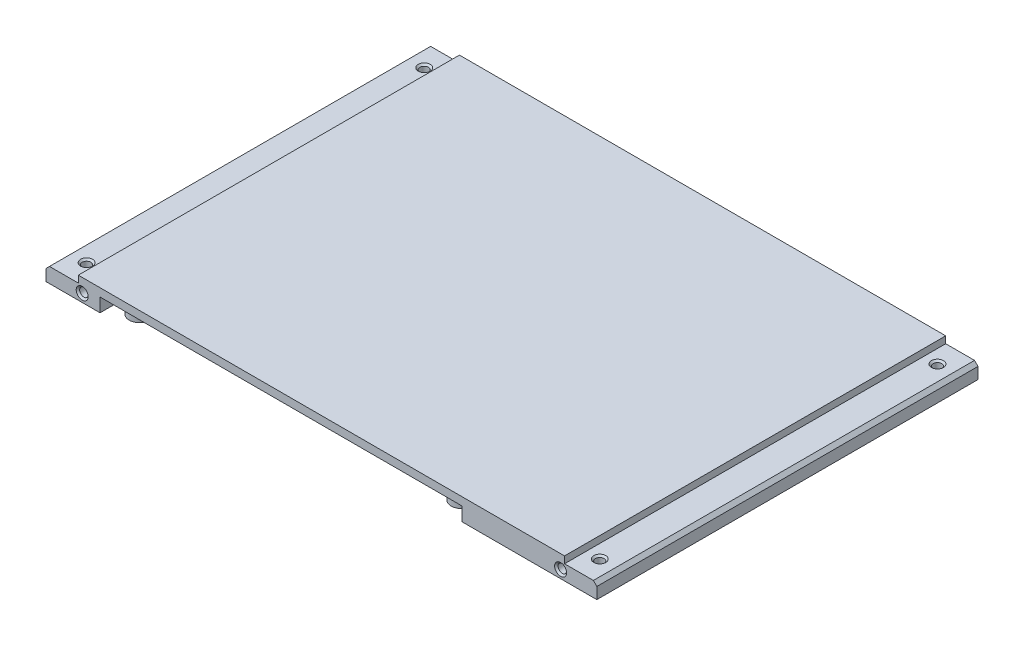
SolidWorks part; units mm, degrees
ref_plane "Front Plane" through (0, 0, 0) normal (0, 0, 1) x (1, 0, 0)
ref_plane "Top Plane" through (0, 0, 0) normal (0, 1, 0) x (1, 0, 0)
ref_plane "Right Plane" through (0, 0, 0) normal (1, 0, 0) x (0, 0, -1)
sketch "Sketch1" plane through (0, 0, 0) normal (0, 0, 1) x (1, 0, 0)
  line L0 (-70.993, -2) -> (-80.423, -2)
  line L1 (-80.423, -2) -> (-80.423, -6.35)
  line L2 (-80.423, -6.35) -> (80.423, -6.35)
  line L4 (-70.993, -2) -> (-70.993, 0)
  line L5 (-70.993, 0) -> (70.993, 0)
  line L6 (0, -34.925) -> (0, 34.925) construction
  line L7 (80.423, -2) -> (80.423, -6.35)
  line L8 (70.993, -2) -> (80.423, -2)
  line L9 (70.993, -2) -> (70.993, 0)
  line L10 (62.865, -6.35) -> (-62.865, -6.35) construction
extrude "Boss-Extrude1" add sketch "Sketch1" against normal up to surface (111.3 mm away)
sketch "Sketch4" plane through (0, -6.35, 0) normal (0, -1, 0) x (1, 0, 0)
  line L0 (-64.643, 0) -> (-64.643, -77.5615)
  line L1 (-82.55, 0) -> (82.55, 0) construction
  line L2 (-64.643, -77.5615) -> (-22.9997, -77.5615)
  line L3 (-22.9997, -77.5615) -> (-22.9997, -93.0615)
  line L4 (-22.9997, -93.0615) -> (41.0007, -93.0615)
  line L5 (41.0007, -93.0615) -> (41.0007, -77.5615)
  line L6 (41.0007, -77.5615) -> (64.643, -77.5615)
  line L7 (0, -111.3) -> (0, 0) construction
  line L8 (0, -111.3) -> (0, 0) construction
  line L9 (-80.423, 0) -> (80.423, 0) construction
  line L10 (-64.643, 0) -> (41.0007, 0)
  line L11 (64.643, -14.7115) -> (64.643, -40.3865)
  line L12 (-36.79, -55.9365) -> (-36.79, -43.2365) construction
  line L13 (-36.79, -55.9365) -> (-24.09, -55.9365) construction
  line L14 (-24.09, -55.9365) -> (-24.09, -43.2365) construction
  line L15 (-36.79, -43.2365) -> (-24.09, -43.2365) construction
  line L16 (-36.79, -55.9365) -> (-36.79, -43.2365)
  line L17 (-36.79, -55.9365) -> (-24.09, -55.9365)
  line L18 (-24.09, -55.9365) -> (-24.09, -43.2365)
  line L19 (-36.79, -43.2365) -> (-24.09, -43.2365)
  line L20 (64.643, -51.8865) -> (64.643, -77.5615)
  line L21 (39.5007, -40.3865) -> (64.643, -40.3865)
  line L22 (39.5007, -40.3865) -> (39.5007, -51.8865)
  line L23 (39.5007, -51.8865) -> (64.643, -51.8865)
  line L28 (64.643, -14.7115) -> (41.0007, -14.7115)
  line L29 (41.0007, 0) -> (41.0007, -14.7115)
  circle A0 centre (-58.5, -71.3865) radius 3 construction
  circle A1 centre (35.5, -71.3865) radius 3 construction
  circle A2 centre (35.5, -5.3865) radius 3 construction
  circle A3 centre (-58.5, -5.3865) radius 3 construction
  circle A4 centre (-58.5, -71.3865) radius 3
  circle A5 centre (35.5, -71.3865) radius 3
  circle A6 centre (35.5, -5.3865) radius 3
  circle A7 centre (-58.5, -5.3865) radius 3
  dimension "D1" = 3.175
  dimension "D6" = 31
  dimension "D2" = 64.643
  dimension "D3" = 41.6433
  dimension "D4" = 64.0004
  dimension "D5" = 15.5
  dimension "D7" = 11.5
  dimension "D8" = 1.5
extrude "Cut-Extrude1" cut sketch "Sketch4" against normal blind 4
sketch "Sketch5" plane through (0, -6.35, 0) normal (0, -1, 0) x (1, 0, 0)
  line L4 (-36.79, -43.2365) -> (-36.79, -55.9365)
  line L5 (-36.79, -55.9365) -> (-24.09, -55.9365)
  line L6 (-24.09, -55.9365) -> (-24.09, -43.2365)
  line L7 (-24.09, -43.2365) -> (-36.79, -43.2365)
  line L8 (-36.79, -43.2365) -> (-36.79, -55.9365)
  line L9 (-36.79, -55.9365) -> (-24.09, -55.9365)
  line L10 (-24.09, -55.9365) -> (-24.09, -43.2365)
  line L11 (-24.09, -43.2365) -> (-36.79, -43.2365)
  dimension "D1" = 0
extrude "Cut-Extrude2" cut sketch "Sketch5" against normal blind 2.1
sketch "Sketch15" plane through (0, -2.35, 0) normal (0, -1, 0) x (1, 0, 0)
  circle A0 centre (34, -85.88) radius 3 construction
  circle A1 centre (-16, -85.88) radius 3 construction
  circle A2 centre (34, -35.88) radius 3 construction
  circle A3 centre (-16, -35.88) radius 3 construction
  circle A4 centre (34, -85.88) radius 3
  circle A5 centre (-16, -85.88) radius 3
  circle A6 centre (34, -35.88) radius 3
  circle A7 centre (-16, -35.88) radius 3
extrude "Boss-Extrude3" add sketch "Sketch15" along normal blind 3
hole_wizard "M3x0.5 Tapped Hole1" positions "Sketch2" profile "Sketch3" tap size "M3x0.5" standard "ANSI Metric"
sketch "Sketch2" plane through (0, -2, 0) normal (0, 1, 0) x (1, 0, 0)
  point P0 (-74.93, 6.35)
  point P3 (-74.93, 104.95)
  point P6 (74.93, 104.95)
  point P9 (74.93, 6.35)
sketch "Sketch3" plane through (-74.93, -2, -6.35) normal (1, 0, 0) x (0, 0, 1)
  line L0 (0, 0) -> (0, 4.35)
  line L1 (0, 4.35) -> (1.25, 4.35)
  line L2 (1.25, 4.35) -> (1.25, 0.5)
  line L3 (1.25, 0.5) -> (1.75, 0)
  line L5 (1.75, 0) -> (0, 0)
  line L6 (-1.25, 0.5) -> (-1.75, 0) construction
  line L11 (0, -6.35) -> (0, 107.95) construction
  dimension "Thru Tap Drill Dia." = 2.5
  dimension "Thru Tap Drill Depth" = 4.35
  dimension "Near C'Sink Dia." = 3.5
  dimension "Near C'Sink Angle" = 90
hole_wizard "M3x0.5 Tapped Hole2" positions "Sketch6" profile "Sketch7" tap size "M3x0.5" standard "ANSI Metric"
sketch "Sketch6" plane through (0, -6.35, 0) normal (0, -1, 0) x (-1, 0, 0)
  point P0 (68, 97.88)
  point P3 (58.5, 71.3865)
  point P6 (68, 20.88)
  point P9 (58.5, 5.3865)
  point P12 (-35.5, 71.3865)
  point P15 (-35.5, 5.3865)
  point P18 (-68, 97.88)
  point P21 (-68, 20.88)
sketch "Sketch7" plane through (-68, -6.35, -97.88) normal (1, 0, 0) x (0, 0, -1)
  line L0 (0, 0) -> (0, 5.5)
  line L1 (0, 5.5) -> (1.25, 4.7489)
  line L2 (1.25, 4.7489) -> (1.25, 0.5)
  line L3 (1.25, 0.5) -> (1.75, 0)
  line L5 (1.75, 0) -> (0, 0)
  line L6 (-1.25, 0.5) -> (-1.75, 0) construction
  line L10 (0, 5.5) -> (-1.25, 4.7489) construction
  line L11 (0, -6.35) -> (0, 107.95) construction
  dimension "Tap Drill Dia." = 2.5
  dimension "Tap Drill Depth" = 5.5
  dimension "Near C'Sink Dia." = 3.5
  dimension "Near C'Sink Angle" = 90
  dimension "Drill Angle" = 118
hole_wizard "M3x0.5 Tapped Hole3" positions "Sketch8" profile "Sketch9" tap size "M3x0.5" standard "ANSI Metric"
sketch "Sketch8" plane through (0, 0, 0) normal (0, 0, 1) x (1, 0, 0)
  point P0 (-69.85, -4)
  point P3 (69.85, -4)
sketch "Sketch9" plane through (-69.85, -4, 0) normal (1, 0, 0) x (0, -1, 0)
  line L0 (0, 0) -> (0, 10)
  line L1 (0, 10) -> (1.25, 9.2489)
  line L2 (1.25, 9.2489) -> (1.25, 0.5)
  line L3 (1.25, 0.5) -> (1.75, 0)
  line L5 (1.75, 0) -> (0, 0)
  line L6 (-1.25, 0.5) -> (-1.75, 0) construction
  line L10 (0, 10) -> (-1.25, 9.2489) construction
  line L11 (0, -6.35) -> (0, 107.95) construction
  dimension "Tap Drill Dia." = 2.5
  dimension "Tap Drill Depth" = 10
  dimension "Near C'Sink Dia." = 3.5
  dimension "Near C'Sink Angle" = 90
  dimension "Drill Angle" = 118
hole_wizard "M3x0.5 Tapped Hole4" positions "Sketch10" profile "Sketch11" tap size "M3x0.5" standard "ANSI Metric"
sketch "Sketch10" plane through (0, 0, -111.3) normal (0, 0, -1) x (-1, 0, 0)
  point P0 (-69.85, -4)
  point P3 (69.85, -4)
  point P6 (0, -4)
sketch "Sketch11" plane through (69.85, -4, -111.3) normal (1, 0, 0) x (0, 1, 0)
  line L0 (0, 0) -> (0, 10)
  line L1 (0, 10) -> (1.25, 9.2489)
  line L2 (1.25, 9.2489) -> (1.25, 0.5)
  line L3 (1.25, 0.5) -> (1.75, 0)
  line L5 (1.75, 0) -> (0, 0)
  line L6 (-1.25, 0.5) -> (-1.75, 0) construction
  line L10 (0, 10) -> (-1.25, 9.2489) construction
  line L11 (0, -6.35) -> (0, 107.95) construction
  dimension "Tap Drill Dia." = 2.5
  dimension "Tap Drill Depth" = 10
  dimension "Near C'Sink Dia." = 3.5
  dimension "Near C'Sink Angle" = 90
  dimension "Drill Angle" = 118
hole_wizard "M3x0.5 Tapped Hole5" positions "Sketch16" profile "Sketch17" tap size "M3x0.5" standard "ANSI Metric"
sketch "Sketch16" plane through (0, -5.35, 0) normal (0, -1, 0) x (-1, 0, 0)
  point P0 (16, 35.88)
  point P3 (-34, 35.88)
  point P6 (16, 85.88)
  point P9 (-34, 85.88)
sketch "Sketch17" plane through (-16, -5.35, -35.88) normal (1, 0, 0) x (0, 0, -1)
  line L0 (0, 0) -> (0, 4.5)
  line L1 (0, 4.5) -> (1.25, 3.7489)
  line L2 (1.25, 3.7489) -> (1.25, 0.5)
  line L3 (1.25, 0.5) -> (1.75, 0)
  line L5 (1.75, 0) -> (0, 0)
  line L6 (-1.25, 0.5) -> (-1.75, 0) construction
  line L10 (0, 4.5) -> (-1.25, 3.7489) construction
  line L11 (0, -6.35) -> (0, 107.95) construction
  dimension "Tap Drill Dia." = 2.5
  dimension "Tap Drill Depth" = 4.5
  dimension "Near C'Sink Dia." = 3.5
  dimension "Near C'Sink Angle" = 90
  dimension "Drill Angle" = 118
hole_wizard "M2.5x0.45 Tapped Hole1" positions "Sketch18" profile "Sketch19" tap size "M2.5x0.45" standard "ANSI Metric"
sketch "Sketch18" plane through (0, -6.35, 0) normal (0, -1, 0) x (-1, 0, 0)
  line L0 (80.423, 111.3) -> (80.423, 0) construction
  line L1 (-80.423, 111.3) -> (80.423, 111.3) construction
  point P0 (26, 80.75)
  point P3 (26, 104.95)
  point P6 (66.3, 104.95)
  point P19 (65.55, 82)
  dimension "D1" = 24.2
  dimension "D2" = 40.3
  dimension "D3" = 54.423
  dimension "D4" = 6.35
  dimension "D5" = 22.95
  dimension "D6" = 39.55
sketch "Sketch19" plane through (-26, -6.35, -80.75) normal (1, 0, 0) x (0, 0, -1)
  line L0 (0, 0) -> (0, 5.5)
  line L1 (0, 5.5) -> (1.025, 4.8841)
  line L2 (1.025, 4.8841) -> (1.025, 0.475)
  line L3 (1.025, 0.475) -> (1.5, 0)
  line L5 (1.5, 0) -> (0, 0)
  line L6 (-1.025, 0.475) -> (-1.5, 0) construction
  line L10 (0, 5.5) -> (-1.025, 4.8841) construction
  line L11 (0, -6.35) -> (0, 107.95) construction
  dimension "Tap Drill Dia." = 2.05
  dimension "Tap Drill Depth" = 5.5
  dimension "Near C'Sink Dia." = 3
  dimension "Near C'Sink Angle" = 90
  dimension "Drill Angle" = 118
fillet "Fillet1" radius 1.5875 12 edges at (41.0007, -4.35, -77.5615) (41.0007, -4.35, -93.0615) (-22.9997, -4.35, -93.0615) (-22.9997, -4.35, -77.5615) (-64.643, -4.35, -77.5615) (39.5007, -4.35, -40.3865) (39.5007, -4.35, -51.8865) (64.643, -4.35, -40.3865) (64.643, -4.35, -77.5615) (64.643, -4.35, -51.8865) (41.0007, -4.35, -14.7115) (64.643, -4.35, -14.7115)
chamfer "Chamfer1" distance 1.016 angle 45 2 edges at (-80.423, -2, -55.65) (80.423, -2, -55.65)
sketch "Sketch20" plane through (0, -6.35, 0) normal (0, -1, 0) x (1, 0, 0)
  line L0 (39.5007, -50.299) -> (39.5007, -41.974) construction
  line L1 (64.643, -38.799) -> (39.5007, -38.799)
  line L2 (64.643, -38.799) -> (64.643, -53.474)
  line L3 (64.643, -53.474) -> (39.5007, -53.474)
  line L4 (39.5007, -38.799) -> (39.5007, -53.474)
extrude "Cut-Extrude3" cut sketch "Sketch20" against normal blind 2
